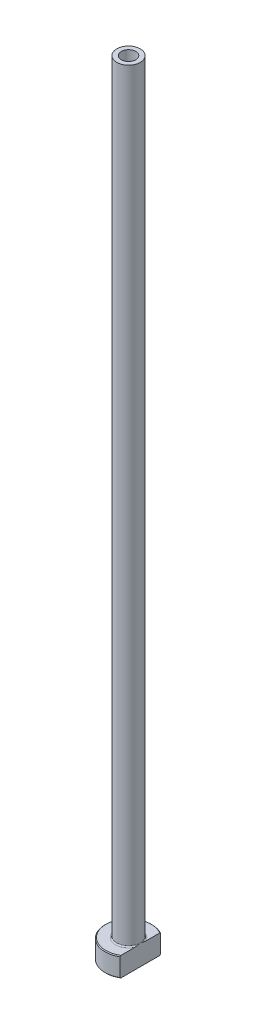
SolidWorks part; units mm, degrees
ref_plane "Front Plane" through (0, 0, 0) normal (0, 0, 1) x (1, 0, 0)
ref_plane "Top Plane" through (0, 0, 0) normal (0, 1, 0) x (1, 0, 0)
ref_plane "Right Plane" through (0, 0, 0) normal (1, 0, 0) x (0, 0, -1)
sketch "Sketch1" plane through (0, 0, 0) normal (0, 0, 1) x (1, 0, 0)
  line L0 (-1.85, 200) -> (-3, 200)
  line L1 (-3, 200) -> (-3, 5)
  line L2 (-3, 5) -> (-6, 5)
  line L3 (-6, 5) -> (-6, 0)
  line L4 (4.95, 0) -> (-4.95, 0) construction
  line L5 (-6, 0) -> (-2.1, 0)
  line L6 (-1.85, 155) -> (-1.85, 200)
  line L7 (0, 92.1877) -> (0, -15.5353) construction
  line L8 (0, -6.6) -> (0, 6.6) construction
  line L9 (-1.85, 155) -> (-2.1, 143)
  line L10 (-2.1, 143) -> (-2.1, 0)
  dimension "D1" = 0.25
  dimension "ID" = 3.7
  dimension "OD" = 6
  dimension "L" = 200
  dimension "H" = 12
  dimension "T" = 5
  dimension "N" = 45
  dimension "D2" = 12
  dimension "L-N" = 155
revolve "Revolve1" add sketch "Sketch1" angle 360 about L7
fillet "Fillet1" radius 0.3 1 edges at (0, 5, 3)
chamfer "Chamfer1" distance 0.2 angle 45 2 edges at (0, 5, 6) (0, 0, 6)
sketch "Sketch2" plane through (0, 0, 0) normal (0, -1, 0) x (1, 0, 0)
  line L0 (3, 5.1962) -> (3, -5.1962)
  circle A0 centre (0, 0) radius 6 construction
  arc A1 (3, 5.1962) -> (3, -5.1962) centre (0, 0) cw
  circle A2 centre (0, 0) radius 3 construction
extrude "Cut-Extrude1" cut sketch "Sketch2" against normal through all
chamfer "Chamfer2" distance 0.5 angle 45 1 edges at (0, 0, 2.1)
